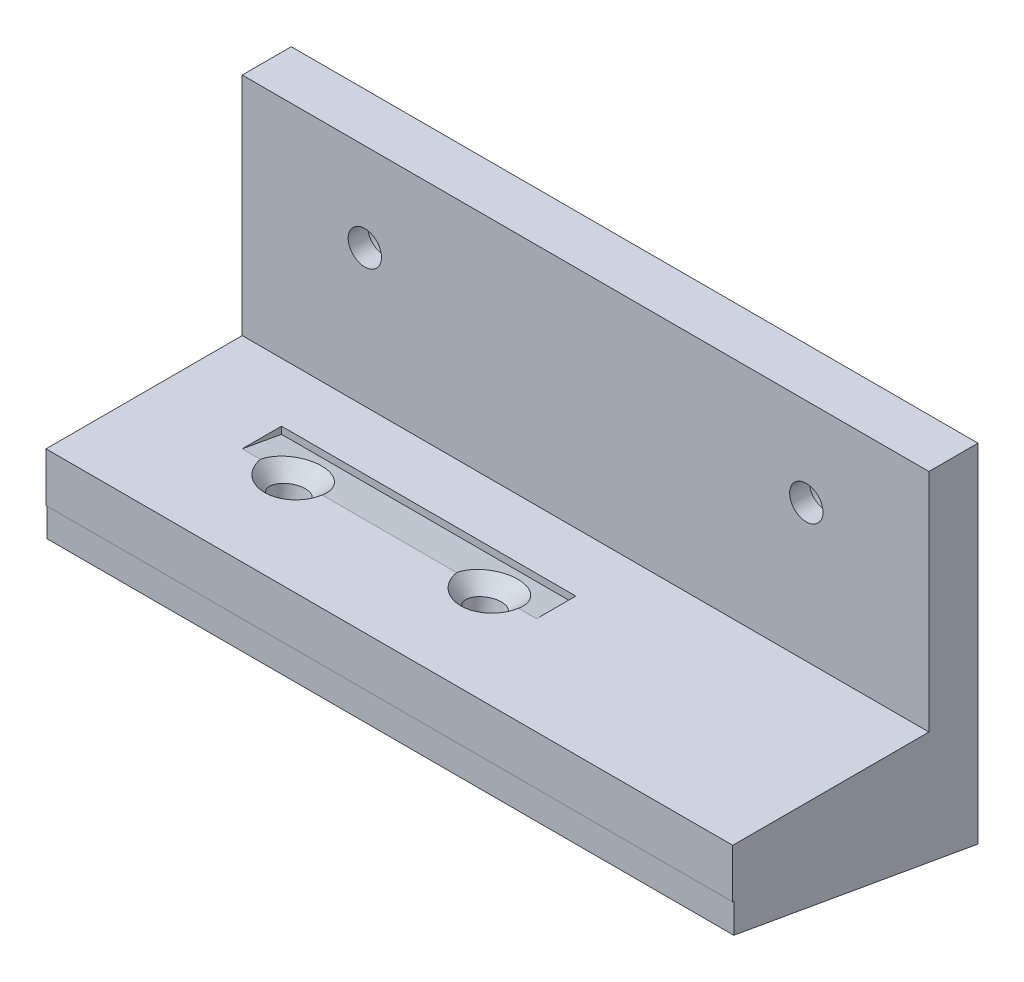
SolidWorks part; units mm, degrees
ref_plane "Front Plane" through (0, 0, 0) normal (0, 0, 1) x (1, 0, 0)
ref_plane "Top Plane" through (0, 0, 0) normal (0, 1, 0) x (1, 0, 0)
ref_plane "Right Plane" through (0, 0, 0) normal (1, 0, 0) x (0, 0, -1)
sketch "Sketch1" plane through (0, 0, 0) normal (0, 0, 1) x (1, 0, 0)
  line L0 (-35, -14) -> (-35, 14)
  line L5 (-35, -14) -> (35, -14)
  line L6 (-35, 14) -> (35, 14)
  line L7 (35, -14) -> (35, 14)
  line L8 (-35, -14) -> (35, 14) construction
  line L9 (-35, 14) -> (35, -14) construction
  point P1 (0, 0)
  dimension "D1" = 70
  dimension "D2" = 28
extrude "MainExtrude" add sketch "Sketch1" along normal blind 25
sketch "Sketch3" plane through (35, 0, 0) normal (1, 0, 0) x (0, 0, -1)
  line L0 (0, -14) -> (0, 14) construction
  line L1 (-25, 14) -> (-5, 14)
  line L2 (-25, 14) -> (-25, -9)
  line L3 (-25, -9) -> (-5, -9)
  line L4 (-5, 14) -> (-5, -9)
  line L5 (-25, -14) -> (0, -14) construction
  dimension "D1" = 5
  dimension "D2" = 5
extrude "L Bracket cut" cut sketch "Sketch3" against normal through all
sketch "Sketch4" plane through (0, -9, 0) normal (0, 1, 0) x (1, 0, 0)
  line L0 (-35, -5) -> (-20, -25)
  line L1 (-35, -25) -> (35, -25) construction
  line L2 (-20, -25) -> (-35, -25)
  line L3 (-35, -25) -> (-35, -5) construction
  line L4 (-35, -25) -> (-35, -5)
  line L5 (0, -59.1307) -> (0, 59.1307) construction
  line L6 (20, -25) -> (35, -25)
  line L7 (35, -5) -> (20, -25)
  line L8 (35, -25) -> (35, -5)
  dimension "D1" = 15
extrude "Cut-Extrude2" [suppressed] cut sketch "Sketch4" against normal through all
ref_plane "Plane 1" through (12.5, 0, 0) normal (1, 0, 0) x (0, 0, -1)
ref_plane "Plane 2" through (-12.5, 0, 0) normal (1, 0, 0) x (0, 0, -1)
sketch "Realsense mount placement" plane through (0, 0, 0) normal (0, 0, -1) x (-1, 0, 0)
  line L0 (0, 59.1307) -> (0, -59.1307) construction
  line L1 (35, -14) -> (-35, -14) construction
  point P0 (22.5, 5)
  point P5 (-22.5, 5)
  dimension "D1" = 22.5
  dimension "D2" = 19
sketch "PanTilt Hole" plane through (0, -9, 0) normal (0, 1, 0) x (1, 0, 0)
  line L1 (0, -59.1307) -> (0, 59.1307) construction
  line L2 (-38.5, 0) -> (38.5, 0) construction
  point P0 (0, -15)
  dimension "D1" = 15
fillet "Fillet1" [suppressed] radius 12.5
sketch "Sketch13" plane through (0, 0, 5) normal (0, 0, 1) x (1, 0, 0)
  line L0 (-35, 14) -> (35, 14) construction
  line L1 (-12.5, 14) -> (12.5, 14)
  line L2 (-12.5, 14) -> (-12.5, -9)
  line L3 (-12.5, -9) -> (12.5, -9)
  line L4 (12.5, 14) -> (12.5, -9)
  line L5 (-35, -9) -> (35, -9) construction
  line L6 (-12.5, -59.1307) -> (-12.5, 59.1307) construction
  line L7 (12.5, -59.1307) -> (12.5, 59.1307) construction
extrude "Cut-Extrude6" [suppressed] cut sketch "Sketch13" against normal through all contours L2 L1 L4 L3
chamfer "Chamfer1" [suppressed] distance 5 angle 45
sketch "Sketch14" plane through (-35, 0, 0) normal (-1, 0, 0) x (0, 0, 1)
  line L0 (5, 14) -> (25, -9)
hole_wizard "CBORE for M3 SHCS1" positions "3DSketch1" profile "Sketch16" counterbore size "M3" standard "ANSI Metric"
sketch3d "3DSketch1"
  point P0 (22.5, 5, 0)
  point P3 (-22.5, 5, 0)
sketch "Sketch16" plane through (22.5, 5, 0) normal (1, 0, 0) x (0, 1, 0)
  line L0 (0, 0) -> (0, 25)
  line L1 (0, 25) -> (1.7, 25)
  line L3 (1.7, 25) -> (1.7, 3)
  line L4 (1.7, 3) -> (3.25, 3)
  line L5 (3.25, 3) -> (3.25, 0)
  line L7 (3.25, 0) -> (0, 0)
  line L11 (0, -6.35) -> (0, 107.95) construction
  dimension "Thru Hole Dia." = 3.4
  dimension "Thru Hole Depth" = 25
  dimension "C'Bore Dia." = 6.5
  dimension "C'Bore Depth" = 3
sketch "Sketch17" plane through (0, -9, 0) normal (0, 1, 0) x (1, 0, 0)
  point P0 (-20, -15)
  dimension "D1" = 20
sketch "Sketch20" plane through (-35, 0, 0) normal (-1, 0, 0) x (0, 0, 1)
  line L0 (24.8876, -14) -> (0, -14)
  line L2 (0, -21.3884) -> (0, -14)
  line L3 (24.8876, -14) -> (24.8876, -17)
  line L4 (24.8876, -17) -> (0, -21.3884)
  dimension "D1" = 90
  dimension "D2" = 10
  dimension "D3" = 3
extrude "Boss-Extrude1" add sketch "Sketch20" against normal up to surface (70 mm away)
ref_plane "Plane1" through (0, -11.2938, 1.9914) normal (0, -0.9848, 0.1736) x (-1, 0, 0)
hole_wizard "CSK for M3 Flat Head Machine Screw1" positions "Sketch23" profile "Sketch22" countersink size "M3" standard "ANSI Metric"
sketch "Sketch23" plane through (0, -11.2938, 1.9914) normal (0, -0.9848, 0.1736) x (-1, 0, 0)
  point P0 (20, -13.2093)
  point P3 (0, -13.2093)
sketch "Sketch22" plane through (-20, -9, 15) normal (1, 0, 0) x (0, 0.1736, 0.9848)
  line L0 (0, 0) -> (0, 13.9366)
  line L1 (0, 13.9366) -> (1.7, 13.9366)
  line L2 (1.7, 13.9366) -> (1.7, 1.45)
  line L3 (1.7, 1.45) -> (3.15, 0)
  line L5 (3.15, 0) -> (0, 0)
  line L6 (-1.7, 1.45) -> (-3.15, 0) construction
  line L11 (0, -6.35) -> (0, 107.95) construction
  dimension "Thru Hole Dia." = 3.4
  dimension "Thru Hole Depth" = 13.9366
  dimension "Near C'Sink Dia." = 6.3
  dimension "Near C'Sink Angle" = 90
sketch "Sketch24" plane through (-35, 0, 0) normal (-1, 0, 0) x (0, 0, 1)
  line L0 (15, -9) -> (10.9963, -9.7204)
  line L1 (10.9963, -9.7204) -> (10.9963, -9)
  line L2 (25, -9) -> (5, -9) construction
  line L3 (10.9963, -9) -> (15, -9)
  line L4 (17.7191, -9) -> (15, -9) construction
  dimension "D1" = 10.2
extrude "Cut-Extrude10" cut sketch "Sketch24" against normal blind 30 from offset 10 contours L0 L1 L3
